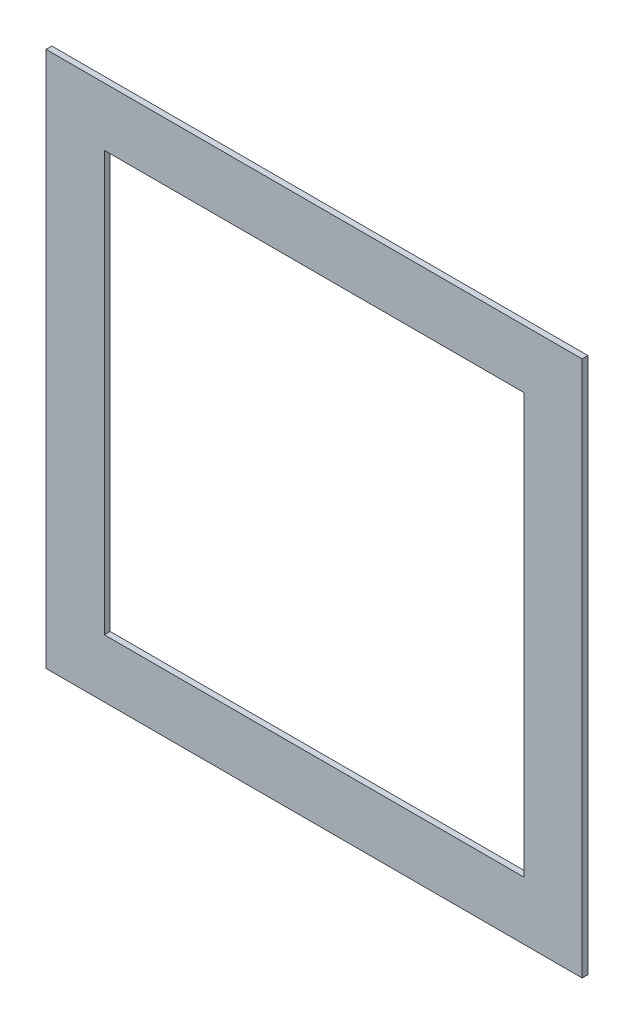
SolidWorks part; units mm, degrees
ref_plane "Front Plane" through (0, 0, 0) normal (0, 0, 1) x (1, 0, 0)
ref_plane "Top Plane" through (0, 0, 0) normal (0, 1, 0) x (1, 0, 0)
ref_plane "Right Plane" through (0, 0, 0) normal (1, 0, 0) x (0, 0, -1)
sketch "Sketch1" plane through (0, 0, 0) normal (0, 0, 1) x (1, 0, 0)
  line L0 (-230, 230) -> (230, 230)
  line L1 (-180, 180) -> (180, 180)
  line L2 (-180, 180) -> (-180, -180)
  line L3 (-180, -180) -> (180, -180)
  line L4 (180, 180) -> (180, -180)
  line L5 (-180, 180) -> (180, -180) construction
  line L6 (-180, -180) -> (180, 180) construction
  line L7 (230, 230) -> (230, -230)
  line L8 (-230, -230) -> (230, -230)
  line L9 (-230, 230) -> (-230, -230)
  point P0 (0, 0)
  dimension "D1" = 360
  dimension "D2" = 50
extrude "Boss-Extrude1" add sketch "Sketch1" along normal mid plane 5
